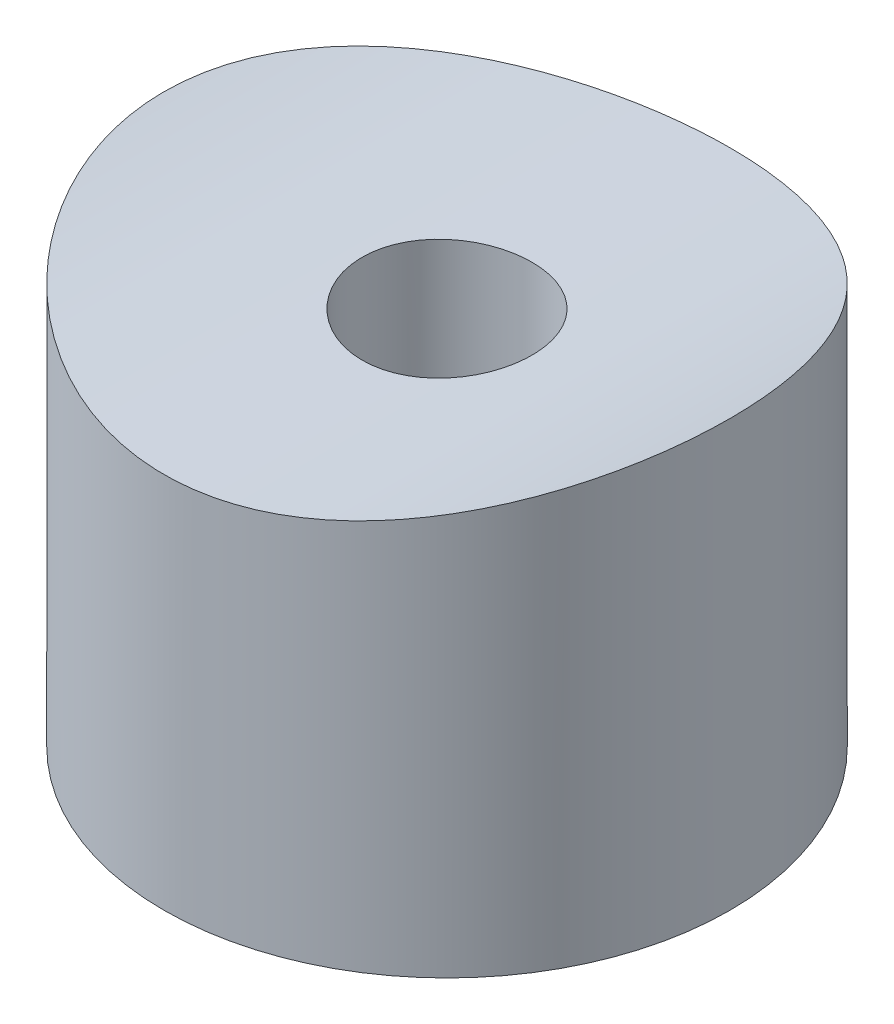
SolidWorks part; units mm, degrees
ref_plane "Front" through (0, 0, 0) normal (0, 0, 1) x (1, 0, 0)
ref_plane "Top" through (0, 0, 0) normal (0, 1, 0) x (1, 0, 0)
ref_plane "Right" through (0, 0, 0) normal (1, 0, 0) x (0, 0, -1)
sketch "Sketch2" plane through (0, 0, 0) normal (0, 1, 0) x (1, 0, 0)
  circle A0 centre (0, 0) radius 2.25
  circle A1 centre (0, 0) radius 7.5
extrude "Extrude1" add sketch "Sketch2" along normal blind 12
sketch "Sketch3" plane through (0, 0, 0) normal (0, 0, 1) x (1, 0, 0)
  circle A0 centre (0, 32.5) radius 22.5
extrude "Cut-Extrude1" cut sketch "Sketch3" against normal mid plane 20
